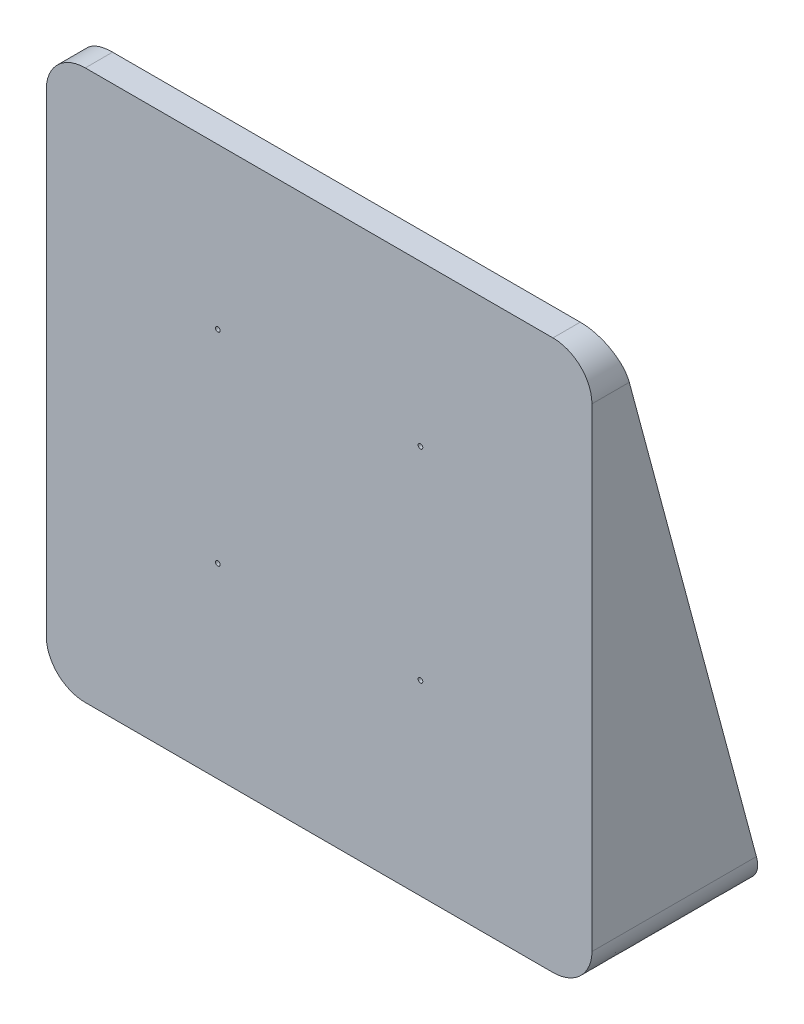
SolidWorks part; units mm, degrees
ref_plane "Front Plane" through (0, 0, 0) normal (0, 0, 1) x (1, 0, 0)
ref_plane "Top Plane" through (0, 0, 0) normal (0, 1, 0) x (1, 0, 0)
ref_plane "Right Plane" through (0, 0, 0) normal (1, 0, 0) x (0, 0, -1)
sketch "Sketch1" plane through (0, 0, 0) normal (0, 0, 1) x (1, 0, 0)
  line L2 (350, 381.5147) -> (350, -227.0186) construction
  line L6 (350, 378.9265) -> (350, -229.6068)
  line L12 (300, -277.9031) -> (-300, -277.9031) construction
  line L13 (300, -277.9031) -> (-300, -277.9031)
  line L14 (-350, -229.6068) -> (-350, 378.9265) construction
  line L15 (-350, -229.6068) -> (-350, 378.9265)
  line L16 (340, -229.6068) -> (340, 378.9265)
  line L17 (300, 417.2228) -> (-300, 417.2228)
  line L18 (-340, 378.9265) -> (-340, -229.6068)
  line L19 (-300, -267.9031) -> (300, -267.9031)
  line L20 (340, -229.6068) -> (340, 378.9265)
  line L21 (300, 417.2228) -> (-300, 417.2228)
  line L22 (-340, 378.9265) -> (-340, -229.6068)
  line L23 (-300, -267.9031) -> (300, -267.9031)
  line L80 (-300, 427.2228) -> (300, 427.2228) construction
  line L81 (-300, 427.2228) -> (300, 427.2228)
  ellipse E5 centre (-300, -229.6068) end of major axis (-350, -229.6068) minor radius 48.2963 (-350, -229.6068) -> (-300, -277.9031) ccw construction
  ellipse E6 centre (-300, 378.9265) end of major axis (-350, 378.9265) minor radius 48.2963 (-300, 427.2228) -> (-350, 378.9265) ccw construction
  ellipse E7 centre (300, 378.9265) end of major axis (250, 378.9265) minor radius 48.2963 (350, 378.9265) -> (300, 427.2228) ccw construction
  ellipse E12 centre (300, -229.6068) end of major axis (250, -229.6068) minor radius 48.2963 (300, -277.9031) -> (350, -229.6068) ccw construction
  ellipse E13 centre (-300, -229.6068) end of major axis (-350, -229.6068) minor radius 48.2963 (-350, -229.6068) -> (-300, -277.9031) ccw
  ellipse E14 centre (300, -229.6068) end of major axis (250, -229.6068) minor radius 48.2963 (300, -277.9031) -> (350, -229.6068) ccw
  ellipse E71 centre (-300, 378.9265) end of major axis (-350, 378.9265) minor radius 48.2963 (-300, 427.2228) -> (-350, 378.9265) ccw
  ellipse E72 centre (300, 378.9265) end of major axis (250, 378.9265) minor radius 48.2963 (350, 378.9265) -> (300, 427.2228) ccw
  spline S0 degree 3 poles (-2529.8476, -467.9929) (-173.4011, 57.3424) (363.881, 270.2075) (338.9352, 387.794) (338.6054, 389.0303) (338.011, 390.8676) (337.7956, 391.4785) (337.3359, 392.6813) (337.0914, 393.2746) (335.7967, 396.2009) (334.5324, 398.4156) (332.2985, 401.5507) (331.4932, 402.5681) (329.8018, 404.4989) (328.9131, 405.417) (327.0522, 407.1614) (326.08, 407.9877) (324.5594, 409.1586) (324.0421, 409.5375) (322.9865, 410.2721) (322.4467, 410.6286) (319.7174, 412.3387) (317.4342, 413.48) (313.8671, 414.868) (312.6541, 415.2763) (310.7981, 415.8056) (310.1722, 415.9684) (308.9182, 416.2636) (308.2893, 416.3962) (162.6581, 443.6046) (-80.4445, -302.1835) (-503.1374, -2462.8398) knots -5.703777 -5.703777 -5.703777 -5.703777 0.125 0.125 0.1875 0.1875 0.21875 0.21875 0.25 0.25 0.375 0.375 0.4375 0.4375 0.5 0.5 0.5625 0.5625 0.59375 0.59375 0.625 0.625 0.75 0.75 0.8125 0.8125 0.84375 0.84375 0.875 0.875 8.058886 8.058886 8.058886 8.058886 only from (340, 378.9265) to (300, 417.2228)
  spline S1 degree 3 poles (571.0287, -2444.0946) (47.8015, -129.1353) (-180.095, 440.2703) (-308.8877, 416.2851) (-310.1309, 415.9941) (-311.9806, 415.4692) (-312.5946, 415.2795) (-313.8177, 414.8698) (-314.4259, 414.65) (-317.4222, 413.4869) (-319.7018, 412.3453) (-322.9456, 410.3176) (-323.9975, 409.5888) (-325.5293, 408.4129) (-326.0335, 408.0061) (-327.016, 407.1727) (-327.4952, 406.7455) (-329.8317, 404.5583) (-331.5125, 402.6452) (-333.3727, 400.0452) (-333.7326, 399.5146) (-334.4275, 398.432) (-334.7634, 397.8782) (-335.7242, 396.1985) (-336.3024, 395.0552) (-337.8541, 391.5561) (-338.6466, 389.1318) (-339.3208, 385.9818) (-339.4398, 385.3446) (-339.6432, 384.0695) (-339.728, 383.4303) (-353.3382, 254.9659) (303.7975, 64.8365) (2578.8683, -275.5984) knots -6.237411 -6.237411 -6.237411 -6.237411 0.125 0.125 0.1875 0.1875 0.21875 0.21875 0.25 0.25 0.375 0.375 0.4375 0.4375 0.46875 0.46875 0.5 0.5 0.625 0.625 0.65625 0.65625 0.6875 0.6875 0.75 0.75 0.875 0.875 0.90625 0.90625 0.9375 0.9375 7.171923 7.171923 7.171923 7.171923 only from (-300, 417.2228) to (-340, 378.9265)
  spline S2 degree 3 poles (2529.8476, 617.3126) (173.4011, 91.9773) (-363.881, -120.8878) (-338.9352, -238.4744) (-338.6054, -239.7106) (-338.011, -241.5479) (-337.7956, -242.1588) (-337.3359, -243.3616) (-337.0914, -243.9549) (-335.7967, -246.8813) (-334.5324, -249.0959) (-332.2985, -252.231) (-331.4932, -253.2484) (-329.8018, -255.1792) (-328.9131, -256.0973) (-327.0522, -257.8417) (-326.08, -258.6681) (-324.5594, -259.839) (-324.0421, -260.2178) (-322.9865, -260.9524) (-322.4467, -261.309) (-319.7174, -263.0191) (-317.4342, -264.1604) (-313.8671, -265.5483) (-312.6541, -265.9566) (-310.7981, -266.486) (-310.1722, -266.6488) (-308.9182, -266.9439) (-308.2893, -267.0765) (-162.6581, -294.285) (80.4445, 451.5032) (503.1374, 2612.1595) knots -5.703777 -5.703777 -5.703777 -5.703777 0.125 0.125 0.1875 0.1875 0.21875 0.21875 0.25 0.25 0.375 0.375 0.4375 0.4375 0.5 0.5 0.5625 0.5625 0.59375 0.59375 0.625 0.625 0.75 0.75 0.8125 0.8125 0.84375 0.84375 0.875 0.875 8.058886 8.058886 8.058886 8.058886 only from (-340, -229.6068) to (-300, -267.9031)
  spline S3 degree 3 poles (-571.0287, 2593.4143) (-47.8015, 278.4549) (180.095, -290.9507) (308.8877, -266.9654) (310.1309, -266.6745) (311.9806, -266.1496) (312.5946, -265.9598) (313.8177, -265.5501) (314.4259, -265.3303) (317.4222, -264.1673) (319.7018, -263.0256) (322.9456, -260.9979) (323.9975, -260.2691) (325.5293, -259.0933) (326.0335, -258.6864) (327.016, -257.853) (327.4952, -257.4259) (329.8317, -255.2387) (331.5125, -253.3256) (333.3727, -250.7255) (333.7326, -250.195) (334.4275, -249.1123) (334.7634, -248.5585) (335.7242, -246.8789) (336.3024, -245.7356) (337.8541, -242.2364) (338.6466, -239.8121) (339.3208, -236.6621) (339.4398, -236.025) (339.6432, -234.7498) (339.728, -234.1107) (353.3382, -105.6463) (-303.7975, 84.4831) (-2578.8683, 424.918) knots -6.237411 -6.237411 -6.237411 -6.237411 0.125 0.125 0.1875 0.1875 0.21875 0.21875 0.25 0.25 0.375 0.375 0.4375 0.4375 0.46875 0.46875 0.5 0.5 0.625 0.625 0.65625 0.65625 0.6875 0.6875 0.75 0.75 0.875 0.875 0.90625 0.90625 0.9375 0.9375 7.171923 7.171923 7.171923 7.171923 only from (300, -267.9031) to (340, -229.6068)
  spline S4 degree 3 poles (340, 378.9265) (340, 381.5123) (339.7292, 384.0516) (338.9352, 387.794) (338.6054, 389.0303) (338.011, 390.8676) (337.7956, 391.4785) (337.3359, 392.6813) (337.0914, 393.2746) (335.7967, 396.2009) (334.5324, 398.4156) (332.2985, 401.5507) (331.4932, 402.5681) (329.8018, 404.4989) (328.9131, 405.417) (327.0522, 407.1614) (326.08, 407.9877) (324.5594, 409.1586) (324.0421, 409.5375) (322.9865, 410.2721) (322.4467, 410.6286) (319.7174, 412.3387) (317.4342, 413.48) (313.8671, 414.868) (312.6541, 415.2763) (310.7981, 415.8056) (310.1722, 415.9684) (308.9182, 416.2636) (308.2893, 416.3962) (305.1356, 416.9854) (302.5828, 417.2228) (300, 417.2228) knots 0 0 0 0 0.125 0.125 0.1875 0.1875 0.21875 0.21875 0.25 0.25 0.375 0.375 0.4375 0.4375 0.5 0.5 0.5625 0.5625 0.59375 0.59375 0.625 0.625 0.75 0.75 0.8125 0.8125 0.84375 0.84375 0.875 0.875 1 1 1 1
  spline S5 degree 3 poles (-300, 417.2228) (-302.5847, 417.2228) (-305.1291, 416.9851) (-308.8877, 416.2851) (-310.1309, 415.9941) (-311.9806, 415.4692) (-312.5946, 415.2795) (-313.8177, 414.8698) (-314.4259, 414.65) (-317.4222, 413.4869) (-319.7018, 412.3453) (-322.9456, 410.3176) (-323.9975, 409.5888) (-325.5293, 408.4129) (-326.0335, 408.0061) (-327.016, 407.1727) (-327.4952, 406.7455) (-329.8317, 404.5583) (-331.5125, 402.6452) (-333.3727, 400.0452) (-333.7326, 399.5146) (-334.4275, 398.432) (-334.7634, 397.8782) (-335.7242, 396.1985) (-336.3024, 395.0552) (-337.8541, 391.5561) (-338.6466, 389.1318) (-339.3208, 385.9818) (-339.4398, 385.3446) (-339.6432, 384.0695) (-339.728, 383.4303) (-339.9316, 381.5082) (-340, 380.2205) (-340, 378.9265) knots 0 0 0 0 0.125 0.125 0.1875 0.1875 0.21875 0.21875 0.25 0.25 0.375 0.375 0.4375 0.4375 0.46875 0.46875 0.5 0.5 0.625 0.625 0.65625 0.65625 0.6875 0.6875 0.75 0.75 0.875 0.875 0.90625 0.90625 0.9375 0.9375 1 1 1 1
  spline S6 degree 3 poles (-340, -229.6068) (-340, -232.1927) (-339.7292, -234.732) (-338.9352, -238.4744) (-338.6054, -239.7106) (-338.011, -241.5479) (-337.7956, -242.1588) (-337.3359, -243.3616) (-337.0914, -243.9549) (-335.7967, -246.8813) (-334.5324, -249.0959) (-332.2985, -252.231) (-331.4932, -253.2484) (-329.8018, -255.1792) (-328.9131, -256.0973) (-327.0522, -257.8417) (-326.08, -258.6681) (-324.5594, -259.839) (-324.0421, -260.2178) (-322.9865, -260.9524) (-322.4467, -261.309) (-319.7174, -263.0191) (-317.4342, -264.1604) (-313.8671, -265.5483) (-312.6541, -265.9566) (-310.7981, -266.486) (-310.1722, -266.6488) (-308.9182, -266.9439) (-308.2893, -267.0765) (-305.1356, -267.6657) (-302.5828, -267.9031) (-300, -267.9031) knots 0 0 0 0 0.125 0.125 0.1875 0.1875 0.21875 0.21875 0.25 0.25 0.375 0.375 0.4375 0.4375 0.5 0.5 0.5625 0.5625 0.59375 0.59375 0.625 0.625 0.75 0.75 0.8125 0.8125 0.84375 0.84375 0.875 0.875 1 1 1 1
  spline S7 degree 3 poles (300, -267.9031) (302.5847, -267.9031) (305.1291, -267.6654) (308.8877, -266.9654) (310.1309, -266.6745) (311.9806, -266.1496) (312.5946, -265.9598) (313.8177, -265.5501) (314.4259, -265.3303) (317.4222, -264.1673) (319.7018, -263.0256) (322.9456, -260.9979) (323.9975, -260.2691) (325.5293, -259.0933) (326.0335, -258.6864) (327.016, -257.853) (327.4952, -257.4259) (329.8317, -255.2387) (331.5125, -253.3256) (333.3727, -250.7255) (333.7326, -250.195) (334.4275, -249.1123) (334.7634, -248.5585) (335.7242, -246.8789) (336.3024, -245.7356) (337.8541, -242.2364) (338.6466, -239.8121) (339.3208, -236.6621) (339.4398, -236.025) (339.6432, -234.7498) (339.728, -234.1107) (339.9316, -232.1885) (340, -230.9009) (340, -229.6068) knots 0 0 0 0 0.125 0.125 0.1875 0.1875 0.21875 0.21875 0.25 0.25 0.375 0.375 0.4375 0.4375 0.46875 0.46875 0.5 0.5 0.625 0.625 0.65625 0.65625 0.6875 0.6875 0.75 0.75 0.875 0.875 0.90625 0.90625 0.9375 0.9375 1 1 1 1
  dimension "D1" = 10
extrude "Boss-Extrude1" add sketch "Sketch1" against normal up to surface (47.941 mm away)
sketch "Sketch2" plane through (0, 0, 0) normal (0, 0, 1) x (1, 0, 0)
  line L4 (-300, -277.9031) -> (300, -277.9031)
  line L5 (350, -229.6068) -> (350, 378.9265)
  line L6 (300, 427.2228) -> (-300, 427.2228)
  line L7 (-350, 378.9265) -> (-350, -229.6068)
  line L8 (-300, -277.9031) -> (300, -277.9031)
  line L9 (350, -229.6068) -> (350, 378.9265)
  line L11 (-350, 378.9265) -> (-350, -229.6068)
  line L12 (300, 427.2228) -> (-300, 427.2228)
  ellipse E4 centre (-300, -229.6068) end of major axis (-350, -229.6068) minor radius 48.2963 (-350, -229.6068) -> (-300, -277.9031) ccw
  ellipse E5 centre (300, -229.6068) end of major axis (250, -229.6068) minor radius 48.2963 (300, -277.9031) -> (350, -229.6068) ccw
  ellipse E6 centre (300, 378.9265) end of major axis (250, 378.9265) minor radius 48.2963 (350, 378.9265) -> (300, 427.2228) ccw
  ellipse E7 centre (300, 378.9265) end of major axis (250, 378.9265) minor radius 48.2963 (350, 378.9265) -> (300, 427.2228) ccw
  ellipse E8 centre (-300, -229.6068) end of major axis (-350, -229.6068) minor radius 48.2963 (-350, -229.6068) -> (-300, -277.9031) ccw
  ellipse E9 centre (300, -229.6068) end of major axis (250, -229.6068) minor radius 48.2963 (300, -277.9031) -> (350, -229.6068) ccw
  ellipse E10 centre (-300, 378.9265) end of major axis (-350, 378.9265) minor radius 48.2963 (-300, 427.2228) -> (-350, 378.9265) ccw
  ellipse E11 centre (-300, 378.9265) end of major axis (-350, 378.9265) minor radius 48.2963 (-300, 427.2228) -> (-350, 378.9265) ccw
  dimension "D1" = 0
extrude "Boss-Extrude2" add sketch "Sketch2" against normal blind 10
sketch "Sketch3" plane through (0, 0, 0) normal (0, 0, 1) x (1, 0, 0)
  line L0 (0, -277.9031) -> (0, 432.3963) construction
  line L1 (-300, -277.9031) -> (300, -277.9031) construction
  line L2 (-315.2096, 432.3963) -> (284.7904, 432.3963) construction
  line L3 (0, 91.7369) -> (187.8679, 91.7369) construction
  circle A0 centre (130, -38.2631) radius 3
  circle A1 centre (130, 221.7369) radius 3
  circle A2 centre (-130, 221.7369) radius 3
  circle A3 centre (-130, -38.2631) radius 3
  dimension "D1" = 6
extrude "Cut-Extrude1" cut sketch "Sketch3" against normal blind 30
